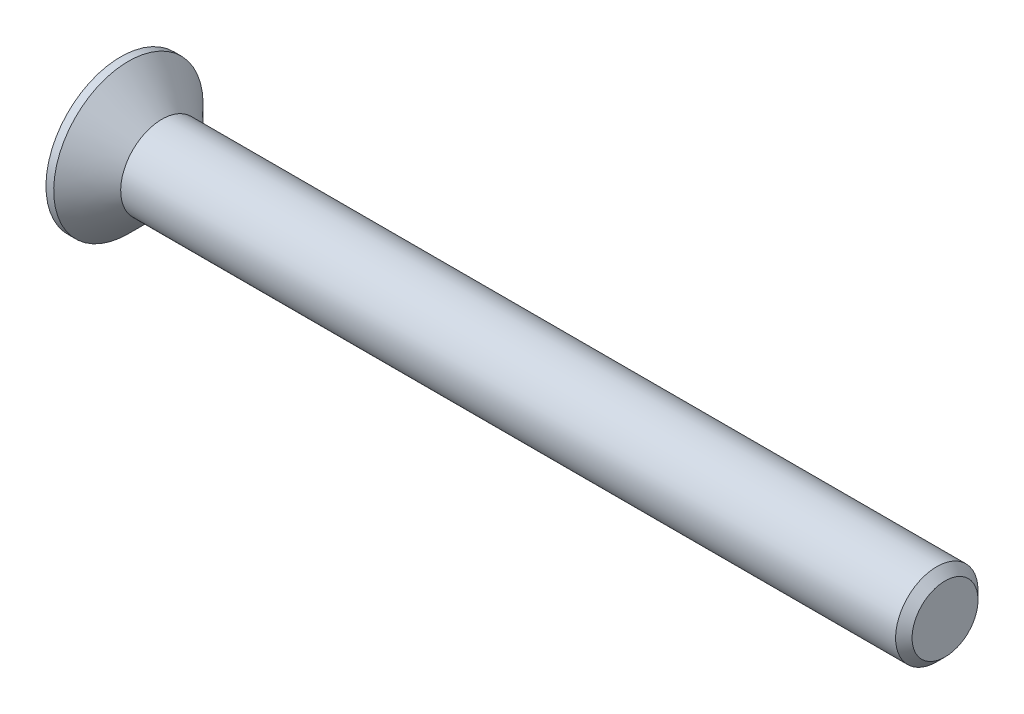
SolidWorks part; units mm, degrees
ref_plane "Front Plane" through (0, 0, 0) normal (0, 0, 1) x (1, 0, 0)
ref_plane "Top Plane" through (0, 0, 0) normal (0, 1, 0) x (1, 0, 0)
ref_plane "Right Plane" through (0, 0, 0) normal (1, 0, 0) x (0, 0, -1)
sketch "Sketch1" plane through (0, 0, 0) normal (0, 0, 1) x (1, 0, 0)
  line L1 (-4, 7.25) -> (-4, 0)
  line L2 (-4, 0) -> (76, 0)
  line L3 (76, 0) -> (76, 4)
  line L4 (76, 4) -> (0, 4)
  line L5 (-4, 7.25) -> (-3.25, 7.25)
  line L6 (-3.25, 7.25) -> (0, 4)
  dimension "D1" = 4
  dimension "D2" = 45
  dimension "D3" = 4
  dimension "D4" = 80
  dimension "D5" = 7.25
revolve "Revolve1" add sketch "Sketch1" angle 360 about L2
chamfer "Chamfer1" distance 0.8 angle 45 1 edges at (76, -4, 0)
sketch "Sketch2" plane through (-4, 0, 0) normal (-1, 0, 0) x (0, 0, 1)
  line L0 (-1.09, 4.35) -> (1.09, 4.35)
  line L1 (1.09, 4.35) -> (1.09, 1.09)
  line L2 (1.09, 1.09) -> (4.35, 1.09)
  line L3 (4.35, 1.09) -> (4.35, -1.09)
  line L4 (4.35, -1.09) -> (1.09, -1.09)
  line L5 (1.09, -1.09) -> (1.09, -4.35)
  line L6 (1.09, -4.35) -> (-1.09, -4.35)
  line L7 (-1.09, -4.35) -> (-1.09, -1.09)
  line L8 (-1.09, -1.09) -> (-4.35, -1.09)
  line L9 (-4.35, -1.09) -> (-4.35, 1.09)
  line L10 (-4.35, 1.09) -> (-1.09, 1.09)
  line L11 (-1.09, 1.09) -> (-1.09, 4.35)
  point P2 (0, 4.35)
  point P14 (0, -4.35)
  point P15 (4.35, 0)
  point P16 (-4.35, 0)
  dimension "D1" = 8.7
  dimension "D2" = 2.18
extrude "Cut-Extrude1" cut sketch "Sketch2" against normal blind 3.45
